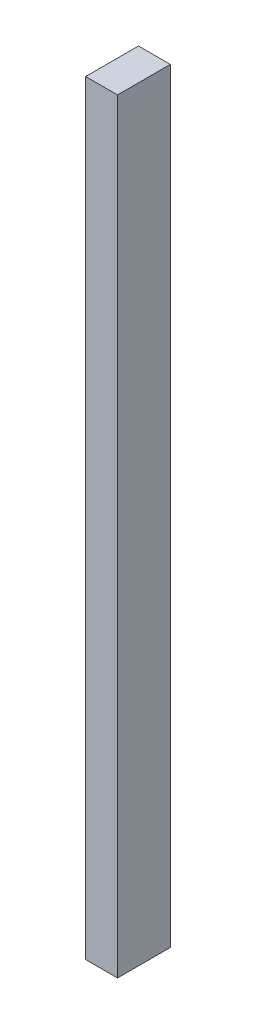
SolidWorks part; units mm, degrees
ref_plane "Front Plane" through (0, 0, 0) normal (0, 0, 1) x (1, 0, 0)
ref_plane "Top Plane" through (0, 0, 0) normal (0, 1, 0) x (1, 0, 0)
ref_plane "Right Plane" through (0, 0, 0) normal (1, 0, 0) x (0, 0, -1)
sketch "Sketch1" plane through (0, 0, 0) normal (0, 0, 1) x (1, 0, 0)
  line L1 (0, 0) -> (38, 0)
  line L2 (0, 0) -> (0, 912)
  line L3 (0, 912) -> (38, 912)
  line L4 (38, 0) -> (38, 912)
  dimension "D1" = 912
  dimension "D2" = 38
extrude "Boss-Extrude1" add sketch "Sketch1" along normal blind 63
ref_plane "Plane1" through (19, 0, 0) normal (-1, 0, 0) x (0, 0, 1)
